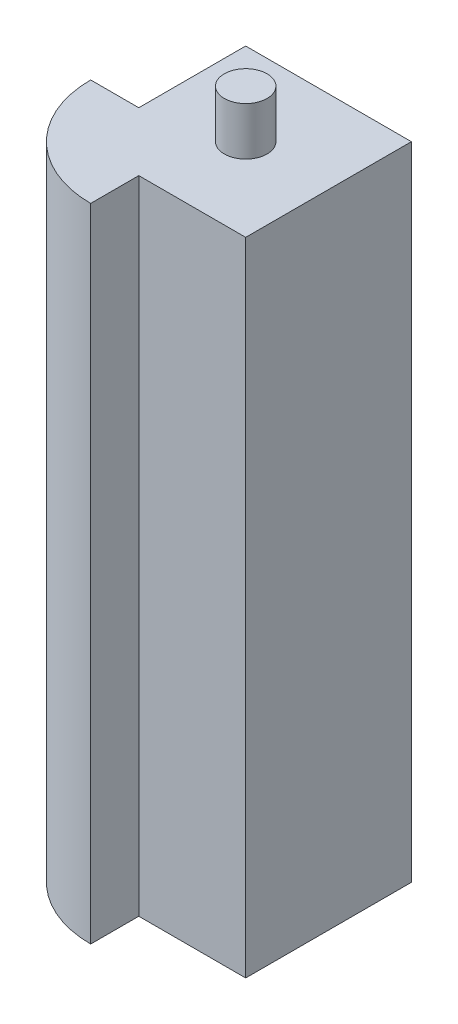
SolidWorks part; units mm, degrees
ref_plane "Front Plane" through (0, 0, 0) normal (0, 0, 1) x (1, 0, 0)
ref_plane "Top Plane" through (0, 0, 0) normal (0, 1, 0) x (1, 0, 0)
ref_plane "Right Plane" through (0, 0, 0) normal (1, 0, 0) x (0, 0, -1)
sketch "Sketch1" plane through (0, 0, 0) normal (0, 1, 0) x (1, 0, 0)
  line L0 (-10, 0) -> (-5.5, 0)
  line L1 (0, -10) -> (0, -5.5)
  line L2 (-5.5, 0) -> (-5.5, 10)
  line L3 (-5.5, 10) -> (-4, 10)
  line L4 (-4, 10) -> (-4, 0)
  line L5 (0, -4) -> (10, -4)
  line L6 (10, -4) -> (10, -5.5)
  line L7 (10, -5.5) -> (0, -5.5)
  line L8 (10, -4) -> (10, 10)
  line L9 (10, 10) -> (-4, 10)
  arc A0 (-10, 0) -> (0, -10) centre (0, 0) ccw
  arc A1 (-4, 0) -> (0, -4) centre (0, 0) ccw
  dimension "D1" = 10
  dimension "D3" = 4.5
  dimension "D4" = 10
  dimension "D2" = 6
extrude "Boss-Extrude1" add sketch "Sketch1" along normal blind 60 contours A1 L4 L3 L2 L0 A0 L1 L7 L6 L5 | L4 A1 L5 L8 L9
sketch "Sketch5" plane through (0, 60, 0) normal (0, 1, 0) x (1, 0, 0)
  line L0 (-5.5, 10) -> (10, -5.5) construction
  line L1 (10, 10) -> (-5.5, -5.5) construction
  line L3 (-5.5, 0) -> (-5.5, -5.5) construction
  line L4 (-5.5, -5.5) -> (0, -5.5) construction
  circle A0 centre (2.25, 2.25) radius 2
  point P7 (2.25, 2.25)
  dimension "D1" = 4
extrude "Boss-Extrude4" add sketch "Sketch5" along normal blind 4.5
sketch "Sketch6" plane through (0, 0, 0) normal (0, -1, 0) x (1, 0, 0)
  line L0 (-5.5, 0) -> (-5.5, 5.5) construction
  line L1 (-5.5, 5.5) -> (0, 5.5) construction
  line L2 (-5.5, 5.5) -> (10, -10) construction
  line L3 (10, 5.5) -> (-5.5, -10) construction
  line L4 (10, 5.5) -> (0, 5.5) construction
  line L5 (-1.7915, -2.25) -> (0.2293, -5.75)
  line L6 (0.2293, -5.75) -> (4.2707, -5.75)
  line L7 (4.2707, -5.75) -> (6.2915, -2.25)
  line L8 (6.2915, -2.25) -> (4.2707, 1.25)
  line L9 (4.2707, 1.25) -> (0.2293, 1.25)
  line L10 (0.2293, 1.25) -> (-1.7915, -2.25)
  circle A0 centre (2.25, -2.25) radius 2
  circle A1 centre (2.25, -2.25) radius 3.5 construction
  point P11 (2.25, -2.25)
  point P12 (5.2811, -4)
  point P22 (0, 1.1068)
  dimension "D1" = 4
  dimension "D2" = 7
extrude "Cut-Extrude1" cut sketch "Sketch6" against normal blind 3.5 contours A0 | L9 L10 L5 L6 L7 L8 A0
sketch "Sketch8" plane through (0, 3.5, 0) normal (0, -1, 0) x (1, 0, 0)
  line L0 (2.25, 1.25) -> (2.25, -5.75) construction
  line L1 (4.2707, 1.25) -> (0.2293, 1.25) construction
  line L2 (0.2293, -5.75) -> (4.2707, -5.75) construction
  line L3 (-1.7915, -2.25) -> (6.2915, -2.25) construction
  circle A0 centre (2.25, -2.25) radius 2
  point P10 (2.25, -2.25)
  dimension "D1" = 4
extrude "Cut-Extrude2" cut sketch "Sketch8" against normal blind 10
